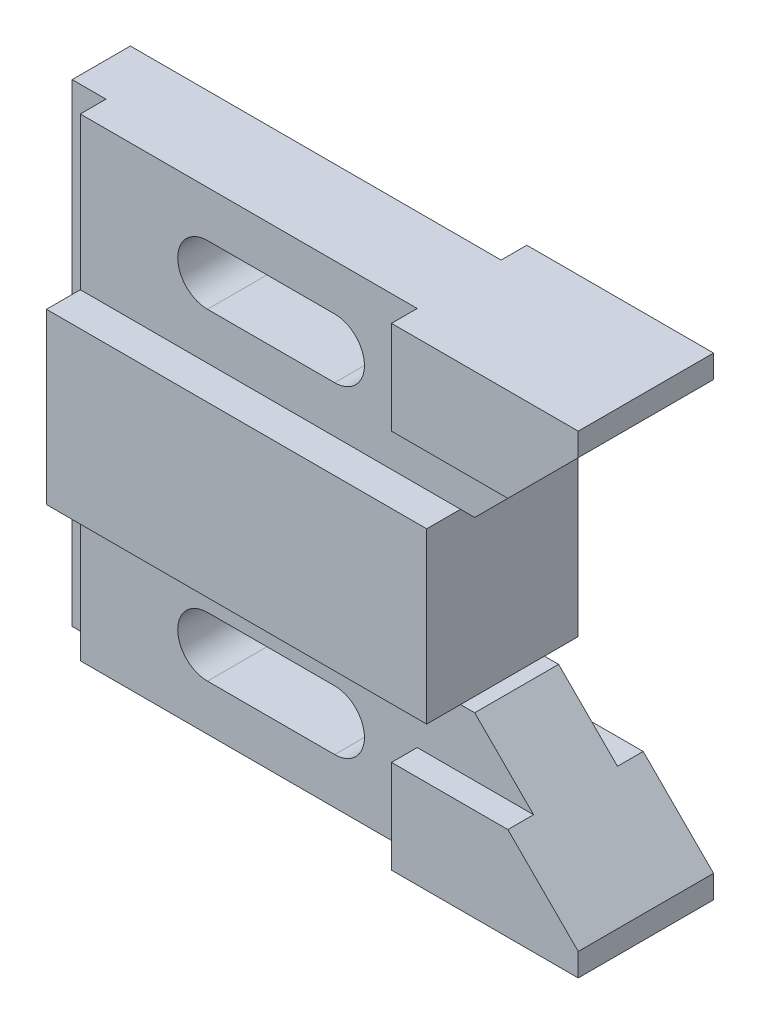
SolidWorks part; units mm, degrees
ref_plane "Front Plane" through (0, 0, 0) normal (0, 0, 1) x (1, 0, 0)
ref_plane "Top Plane" through (0, 0, 0) normal (0, 1, 0) x (1, 0, 0)
ref_plane "Right Plane" through (0, 0, 0) normal (1, 0, 0) x (0, 0, -1)
sketch "Sketch1" plane through (0, 0, 0) normal (0, 0, 1) x (1, 0, 0)
  line L0 (0, 0) -> (0, -88.9)
  line L1 (0, -88.9) -> (104.648, -88.9)
  line L2 (104.648, 0) -> (104.648, -4.3175)
  line L3 (104.648, 0) -> (0, 0)
  line L4 (0, -44.45) -> (214.1346, -44.45) construction
  line L5 (104.648, -4.3175) -> (80.3905, -28.575)
  line L6 (77.724, -28.575) -> (77.724, -44.45)
  line L7 (30.226, -14.224) -> (54.102, -14.224) construction
  line L8 (77.724, -44.45) -> (77.724, -60.325)
  line L9 (30.226, -8.636) -> (54.102, -8.636)
  line L10 (80.3905, -60.325) -> (77.724, -60.325)
  line L11 (30.226, -19.812) -> (54.102, -19.812)
  line L12 (80.3905, -28.575) -> (77.724, -28.575)
  line L13 (30.226, -74.676) -> (54.102, -74.676) construction
  line L14 (104.648, -88.9) -> (104.648, -84.5825)
  line L15 (104.648, -84.5825) -> (80.3905, -60.325)
  line L16 (30.226, -69.088) -> (54.102, -69.088)
  line L17 (30.226, -80.264) -> (54.102, -80.264)
  line L18 (6.35, 0) -> (6.35, -88.9) construction
  circle A0 centre (125.222, -44.45) radius 42.926 construction
  arc A1 (30.226, -8.636) -> (30.226, -19.812) centre (30.226, -14.224) ccw
  arc A2 (54.102, -19.812) -> (54.102, -8.636) centre (54.102, -14.224) ccw
  arc A3 (30.226, -69.088) -> (30.226, -80.264) centre (30.226, -74.676) ccw
  arc A4 (54.102, -80.264) -> (54.102, -69.088) centre (54.102, -74.676) ccw
  point P11 (42.164, -14.224)
  point P25 (42.164, -74.676)
  dimension "D3" = 85.852
  dimension "D6" = 31.75
  dimension "D1" = 88.9
  dimension "D2" = 104.648
  dimension "D4" = 44.45
  dimension "D5" = 20.574
  dimension "D7" = 45
  dimension "D8" = 45
  dimension "D9" = 26.924
  dimension "D10" = 11.176
  dimension "D11" = 23.876
  dimension "D12" = 23.876
  dimension "D13" = 60.452
  dimension "D14" = 6.35
extrude "Boss-Extrude1" add sketch "Sketch1" along normal blind 7.874
sketch "Sketch2" plane through (0, 0, 7.874) normal (0, 0, 1) x (1, 0, 0)
  line L0 (69.596, 0) -> (69.596, -17.526)
  line L1 (104.648, 0) -> (0, 0) construction
  line L2 (69.596, -17.526) -> (91.4395, -17.526)
  line L3 (80.3905, -28.575) -> (104.648, -4.3175) construction
  line L4 (104.648, -4.3175) -> (104.648, 0) construction
  line L5 (69.596, 0) -> (104.648, 0)
  line L6 (104.648, 0) -> (104.648, -4.3175)
  line L7 (104.648, -4.3175) -> (91.4395, -17.526)
  line L8 (69.596, -71.374) -> (69.596, -88.9)
  line L10 (0, -88.9) -> (104.648, -88.9) construction
  line L11 (69.596, -88.9) -> (104.648, -88.9)
  line L12 (104.648, -88.9) -> (104.648, -84.5825)
  line L13 (104.648, -84.5825) -> (91.4395, -71.374)
  line L14 (104.648, -84.5825) -> (80.3905, -60.325) construction
  line L15 (91.4395, -71.374) -> (69.596, -71.374)
  dimension "D1" = 17.526
  dimension "D2" = 35.052
extrude "Boss-Extrude2" add sketch "Sketch2" along normal blind 4.826
sketch "Sketch3" plane through (0, 0, 7.874) normal (0, 0, 1) x (1, 0, 0)
  line L0 (69.596, 0) -> (0, 0) construction
  line L1 (6.35, 0) -> (0, 0)
  line L2 (6.35, 0) -> (6.35, -88.9)
  line L3 (6.35, -88.9) -> (0, -88.9)
  line L4 (0, 0) -> (0, -88.9)
  dimension "D1" = 6.35
extrude "Cut-Extrude1" cut sketch "Sketch3" against normal blind 4.826
sketch "Sketch4" plane through (0, 0, 7.874) normal (0, 0, 1) x (1, 0, 0)
  line L0 (6.35, -88.9) -> (6.35, 0) construction
  line L1 (6.35, -28.575) -> (77.724, -28.575)
  line L2 (6.35, -28.575) -> (6.35, -60.325)
  line L3 (6.35, -60.325) -> (77.724, -60.325)
  line L4 (77.724, -28.575) -> (77.724, -60.325)
  line L5 (0, -44.45) -> (105.8756, -44.45) construction
  line L6 (0, 0) -> (0, -88.9) construction
  line L7 (77.724, -60.325) -> (77.724, -28.575) construction
  dimension "D1" = 31.75
extrude "Boss-Extrude3" add sketch "Sketch4" along normal blind 6.35
mirror "Mirror2" about plane through (0, 0, 0) normal (0, 0, 1) of "Boss-Extrude1", "Boss-Extrude2", "Boss-Extrude3"
sketch "Sketch5" plane through (6.35, 0, 0) normal (-1, 0, 0) x (0, 0, 1)
  line L4 (-7.874, -60.325) -> (-7.874, -28.575)
  line L5 (-7.874, -28.575) -> (-14.224, -28.575)
  line L6 (-14.224, -28.575) -> (-14.224, -60.325)
  line L7 (-14.224, -60.325) -> (-7.874, -60.325)
  line L8 (-7.874, -60.325) -> (-7.874, -28.575)
  line L9 (-7.874, -28.575) -> (-14.224, -28.575)
  line L10 (-14.224, -28.575) -> (-14.224, -60.325)
  line L11 (-14.224, -60.325) -> (-7.874, -60.325)
  dimension "D1" = 0
extrude "Boss-Extrude4" add sketch "Sketch5" along normal up to surface (6.35 mm away)
